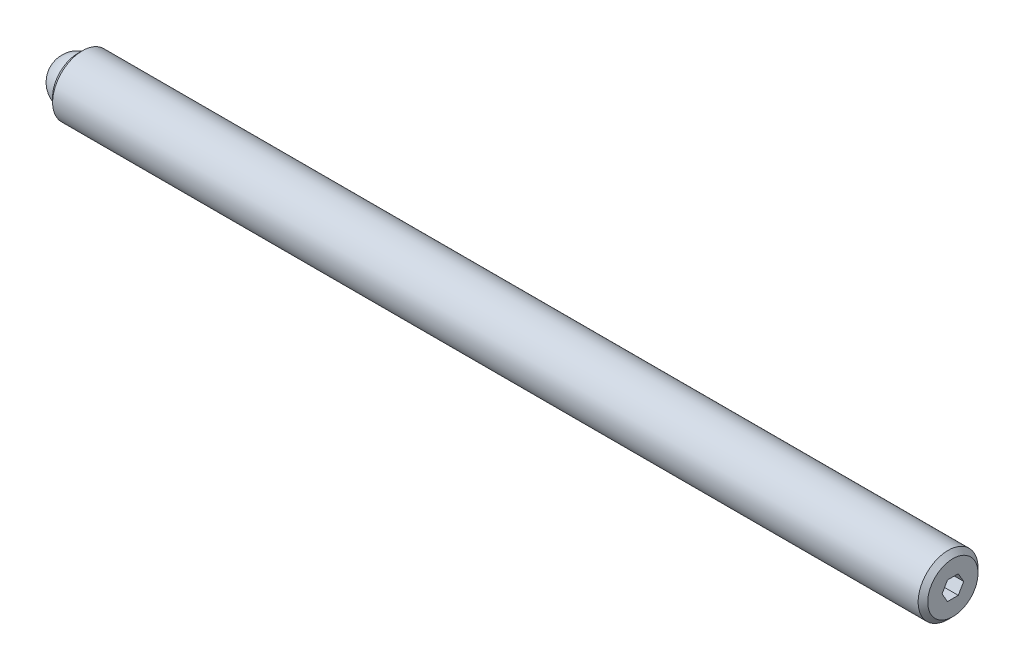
SolidWorks part; units mm, degrees
ref_plane "Front Plane" through (0, 0, 0) normal (0, 0, 1) x (1, 0, 0)
ref_plane "Top Plane" through (0, 0, 0) normal (0, 1, 0) x (1, 0, 0)
ref_plane "Right Plane" through (0, 0, 0) normal (1, 0, 0) x (0, 0, -1)
sketch "Sketch2" plane through (0, 0, 0) normal (1, 0, 0) x (0, 0, -1)
  circle A0 centre (0, 0) radius 3.175
  dimension "D1" = 6.35
extrude "Boss-Extrude1" add sketch "Sketch2" along normal blind 92.8688
sketch "Sketch3" plane through (0, 0, 0) normal (-1, 0, 0) x (0, 0, 1)
  circle A0 centre (0, 0) radius 2.3813
  dimension "D1" = 4.7625
chamfer "Chamfer1" distance 0.508 angle 45 1 edges at (0, 0, -3.175)
chamfer "Chamfer2" distance 0.508 angle 45 1 edges at (92.8688, 0, -3.175)
sketch "Sketch4" plane through (92.8688, 0, 0) normal (1, 0, 0) x (0, 0, -1)
  line L1 (1.1457, 0) -> (0.5728, 0.9922)
  line L2 (0.5728, 0.9922) -> (-0.5728, 0.9922)
  line L3 (-0.5728, 0.9922) -> (-1.1457, 0)
  line L4 (-1.1457, 0) -> (-0.5728, -0.9922)
  line L5 (-0.5728, -0.9922) -> (0.5728, -0.9922)
  line L6 (0.5728, -0.9922) -> (1.1457, 0)
  circle A0 centre (0, 0) radius 0.9922 construction
  dimension "D1" = 1.9844
extrude "Cut-Extrude2" cut sketch "Sketch4" against normal blind 2.286
extrude "Cut-Extrude3" cut sketch "Sketch3" against normal blind 1.9844
sketch "Sketch5" plane through (0, 0, 0) normal (-1, 0, 0) x (0, 0, 1)
  line L0 (0, 0) -> (0, -2.3813)
  line L1 (0, 0) -> (0, 2.3813)
  arc A0 (0, 2.3813) -> (0, -2.3813) centre (0, 0) ccw
  dimension "D1" = 2.3813
revolve "Revolve1" add sketch "Sketch5" angle 360 about L1
